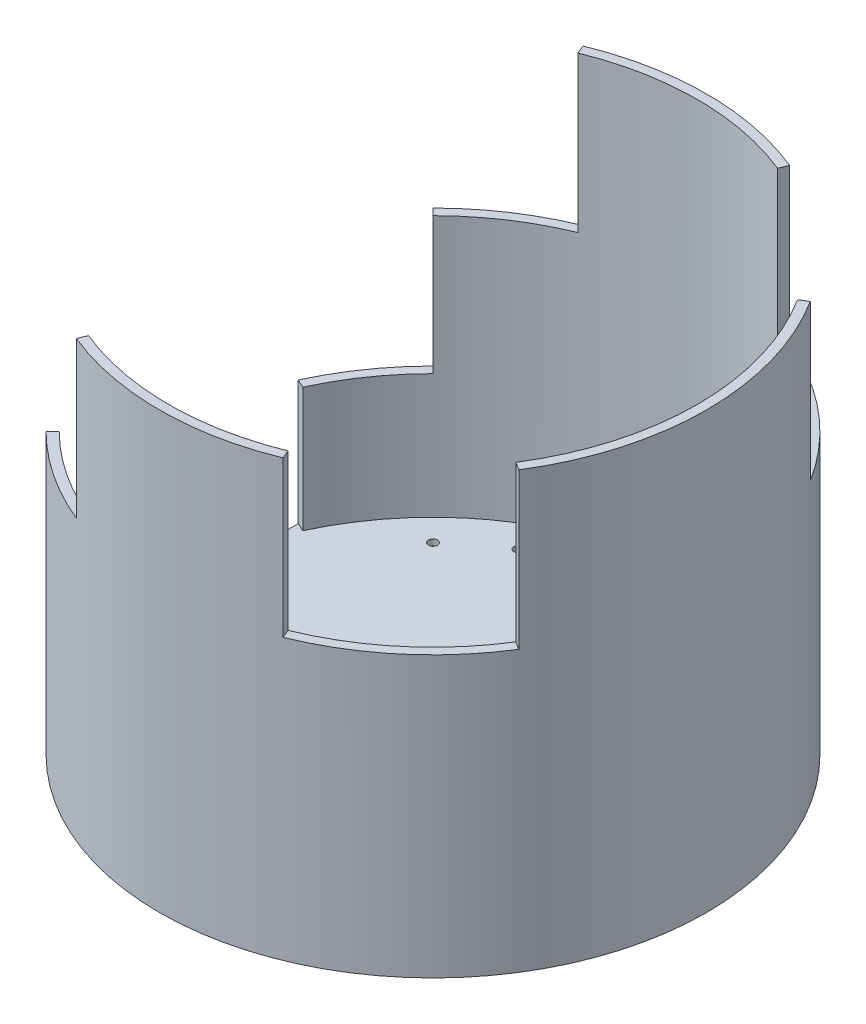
SolidWorks part; units mm, degrees
ref_plane "Plano frontal" through (0, 0, 0) normal (0, 0, 1) x (1, 0, 0)
ref_plane "Plano superior" through (0, 0, 0) normal (0, 1, 0) x (1, 0, 0)
ref_plane "Plano direito" through (0, 0, 0) normal (1, 0, 0) x (0, 0, -1)
sketch "Esboço1" plane through (0, 0, 0) normal (0, 1, 0) x (1, 0, 0)
  circle A0 centre (0, 0) radius 88
  dimension "D1" = 176
extrude "Ressalto-extrusão1" add sketch "Esboço1" along normal blind 6
sketch "Esboço3" plane through (0, 6, 0) normal (0, 1, 0) x (1, 0, 0)
  circle A0 centre (0, 0) radius 88
  circle A1 centre (0, 0) radius 85
  circle A2 centre (0, 0) radius 88 construction
  dimension "D2" = 170
extrude "Ressalto-extrusão2" add sketch "Esboço3" along normal blind 134
sketch "Esboço4" plane through (0, 140, 0) normal (0, 1, 0) x (1, 0, 0)
  line L0 (0, 0) -> (88, 0) construction
  line L1 (0, 0) -> (56.5653, 67.4119) construction
  line L2 (0, 0) -> (56.5653, -67.4119) construction
  line L3 (32.101, 78.7053) -> (71.9353, 45.2804)
  line L4 (34.9071, 85.5853) -> (78.2235, 49.2385)
  line L5 (78.2235, 49.2385) -> (71.9353, 45.2804)
  line L6 (34.9071, 85.5853) -> (32.101, 78.7053)
  line L7 (34.9071, -85.5853) -> (32.101, -78.7053)
  line L8 (78.2235, -49.2385) -> (71.9353, -45.2804)
  line L9 (34.9071, -85.5853) -> (78.2235, -49.2385)
  line L10 (32.101, -78.7053) -> (71.9353, -45.2804)
  line L11 (0, 0) -> (0, 88) construction
  line L12 (-32.101, -78.7053) -> (-71.9353, -45.2804)
  line L13 (-34.9071, -85.5853) -> (-78.2235, -49.2385)
  line L14 (-78.2235, -49.2385) -> (-71.9353, -45.2804)
  line L15 (-34.9071, -85.5853) -> (-32.101, -78.7053)
  line L16 (-34.9071, 85.5853) -> (-32.101, 78.7053)
  line L17 (-78.2235, 49.2385) -> (-71.9353, 45.2804)
  line L18 (-34.9071, 85.5853) -> (-78.2235, 49.2385)
  line L19 (-32.101, 78.7053) -> (-71.9353, 45.2804)
  circle A0 centre (0, 0) radius 88 construction
  circle A1 centre (0, 0) radius 85 construction
  point P13 (52.0182, 61.9928)
  point P16 (56.5653, 67.4119)
  point P20 (56.5653, -67.4119)
  point P21 (52.0182, -61.9928)
  point P27 (-52.0182, -61.9928)
  point P28 (-56.5653, -67.4119)
  point P33 (-56.5653, 67.4119)
  point P34 (-52.0182, 61.9928)
  dimension "D1" = 50
  dimension "D2" = 50
  dimension "D3" = 52
extrude "Corte-extrusão1" cut sketch "Esboço4" against normal blind 50
sketch "Esboço5" plane through (0, 140, 0) normal (0, 1, 0) x (1, 0, 0)
  line L0 (0, 0) -> (-80, 0) construction
  line L1 (-80, 36.6606) -> (-80, -36.6606) construction
  line L2 (-88, -36.6606) -> (-88, 36.6606)
  line L3 (-88, 36.6606) -> (-80, 36.6606)
  line L4 (-88, -36.6606) -> (-80, -36.6606)
  line L5 (-80, 36.6606) -> (-77.2727, 35.4108)
  line L6 (-80, -36.6606) -> (-77.2727, -35.4108)
  line L7 (-77.2727, -35.4108) -> (-77.2727, 35.4108)
  arc A0 (-74.4742, 46.8785) -> (-74.4742, -46.8785) centre (0, 0) ccw construction
  arc A1 (-71.9353, 45.2804) -> (-71.9353, -45.2804) centre (0, 0) ccw construction
  circle A2 centre (0, 0) radius 85 construction
  point P3 (-88, 0)
  point P9 (-80, 0)
  point P12 (-88, 0)
  dimension "D1" = 80
extrude "Corte-extrusão2" cut sketch "Esboço5" against normal through all
sketch "Esboço6" plane through (0, 0, 0) normal (0, 1, 0) x (1, 0, 0)
  line L0 (-80, 36.6606) -> (-77.2727, 35.4108)
  line L1 (-77.2727, 35.4108) -> (-77.2727, -35.4108)
  line L2 (-77.2727, -35.4108) -> (-77.2727, 35.4108) construction
  line L3 (-77.2727, -35.4108) -> (-80, -36.6606)
  line L4 (-80, -36.6606) -> (-80, 36.6606)
extrude "Ressalto-extrusão3" add sketch "Esboço6" along normal offset from surface (46 mm away) 40
sketch "Esboço7" plane through (0, 140, 0) normal (0, 1, 0) x (1, 0, 0)
  line L0 (-74.4742, 46.8785) -> (-71.9353, 45.2804)
  line L1 (-71.9353, 45.2804) -> (-71.9353, -45.2804)
  line L2 (-71.9353, -45.2804) -> (-74.4742, -46.8785)
  line L3 (-74.4742, -46.8785) -> (-80, -46.8785)
  line L4 (-80, -46.8785) -> (-80, 46.8785)
  line L5 (-80, 46.8785) -> (-74.4742, 46.8785)
extrude "Corte-extrusão3" cut sketch "Esboço7" against normal up to surface (94 mm away)
sketch "Esboço8" plane through (0, 140, 0) normal (0, 1, 0) x (1, 0, 0)
  line L0 (0, 0) -> (-80, 0) construction
  line L1 (-80, 36.6606) -> (-80, -36.6606) construction
  line L2 (0, 0) -> (-60.1041, 60.1041) construction
  line L3 (-60.1041, 60.1041) -> (-62.2254, 62.2254)
  line L4 (-62.2254, 62.2254) -> (-80, 62.2254)
  line L5 (-60.1041, 60.1041) -> (-60.1041, -60.1041)
  line L6 (-60.1041, -60.1041) -> (-62.2254, -62.2254)
  line L7 (-62.2254, -62.2254) -> (-80, -62.2254)
  line L8 (-80, -62.2254) -> (-80, 62.2254)
  arc A0 (-32.101, 78.7053) -> (-71.9353, 45.2804) centre (0, 0) ccw construction
  arc A6 (-77.2727, -35.4108) -> (-77.2727, 35.4108) centre (0, 0) ccw construction
  arc A7 (-33.234, 81.4831) -> (-74.4742, 46.8785) centre (0, 0) ccw construction
  point P12 (-62.2254, -62.6342)
  dimension "D1" = 45
  dimension "D2" = 3
  dimension "D3" = 45
extrude "Corte-extrusão4" cut sketch "Esboço8" against normal up to surface (94 mm away)
sketch "Esboço9" plane through (0, 46, 0) normal (0, 1, 0) x (1, 0, 0)
  line L0 (-77.2727, 35.4108) -> (-80, 36.6606)
  line L1 (-80, 36.6606) -> (-80, -36.6606)
  line L2 (-80, -36.6606) -> (-77.2727, -35.4108)
  line L3 (-77.2727, -35.4108) -> (-77.2727, 35.4108)
extrude "Corte-extrusão5" cut sketch "Esboço9" against normal up to surface (40 mm away)
sketch "Esboço10" plane through (0, 0, 0) normal (0, -1, 0) x (1, 0, 0)
  line L0 (0, 0) -> (-55, 0) construction
  line L1 (-55, -64.8074) -> (-55, 64.8074)
  arc A0 (-55, -64.8074) -> (-55, 64.8074) centre (0, 0) ccw
  point P7 (-55, 0)
  dimension "D1" = 170
  dimension "D2" = 55
extrude "Corte-extrusão6" cut sketch "Esboço10" against normal blind 4
sketch "Esboço11" plane through (0, 6, 0) normal (0, 1, 0) x (1, 0, 0)
  line L0 (0, 0) -> (-80, 0) construction
  line L1 (-80, -36.6606) -> (-80, 36.6606) construction
  line L2 (0, 0) -> (-53.033, 53.033) construction
  line L3 (0, 0) -> (-37.5, 64.9519) construction
  line L4 (0, 0) -> (37.5, 64.9519) construction
  line L5 (0, 0) -> (57.4533, 48.2091) construction
  line L6 (0, 0) -> (0, 88) construction
  line L7 (0, 0) -> (57.4533, -48.2091) construction
  line L8 (0, 0) -> (37.5, -64.9519) construction
  line L9 (0, 0) -> (-37.5, -64.9519) construction
  line L10 (0, 0) -> (-53.033, -53.033) construction
  arc A0 (33.234, 81.4831) -> (-33.234, 81.4831) centre (0, 0) ccw construction
  dimension "D1" = 45
  dimension "D2" = 30
  dimension "D3" = 30
  dimension "D4" = 50
  dimension "D5" = 75
hole_wizard "Furo com folga de M2.51" positions "3DSketch1" profile "Esboço12" hole size "M2.5" standard "ISO"
sketch3d "3DSketch1"
  point P0 (-53.033, 6, -53.033)
  point P3 (-37.5, 6, -64.9519)
  point P6 (37.5, 6, -64.9519)
  point P9 (57.4533, 6, -48.2091)
  point P13 (-53.033, 6, 53.033)
  point P16 (-37.5, 6, 64.9519)
  point P19 (37.5, 6, 64.9519)
  point P22 (57.4533, 6, 48.2091)
sketch "Esboço12" plane through (-53.033, 6, -53.033) normal (1, 0, 0) x (0, 0, 1)
  line L0 (0, 0) -> (0, 4.8712)
  line L1 (0, 4.8712) -> (1.45, 4)
  line L2 (1.45, 4) -> (1.45, 0)
  line L5 (1.45, 0) -> (0, 0)
  line L10 (0, 4.8712) -> (-1.45, 4) construction
  line L11 (0, -6.35) -> (0, 107.95) construction
  dimension "Hole Dia." = 2.9
  dimension "Hole Depth" = 4
  dimension "Drill Angle" = 118
